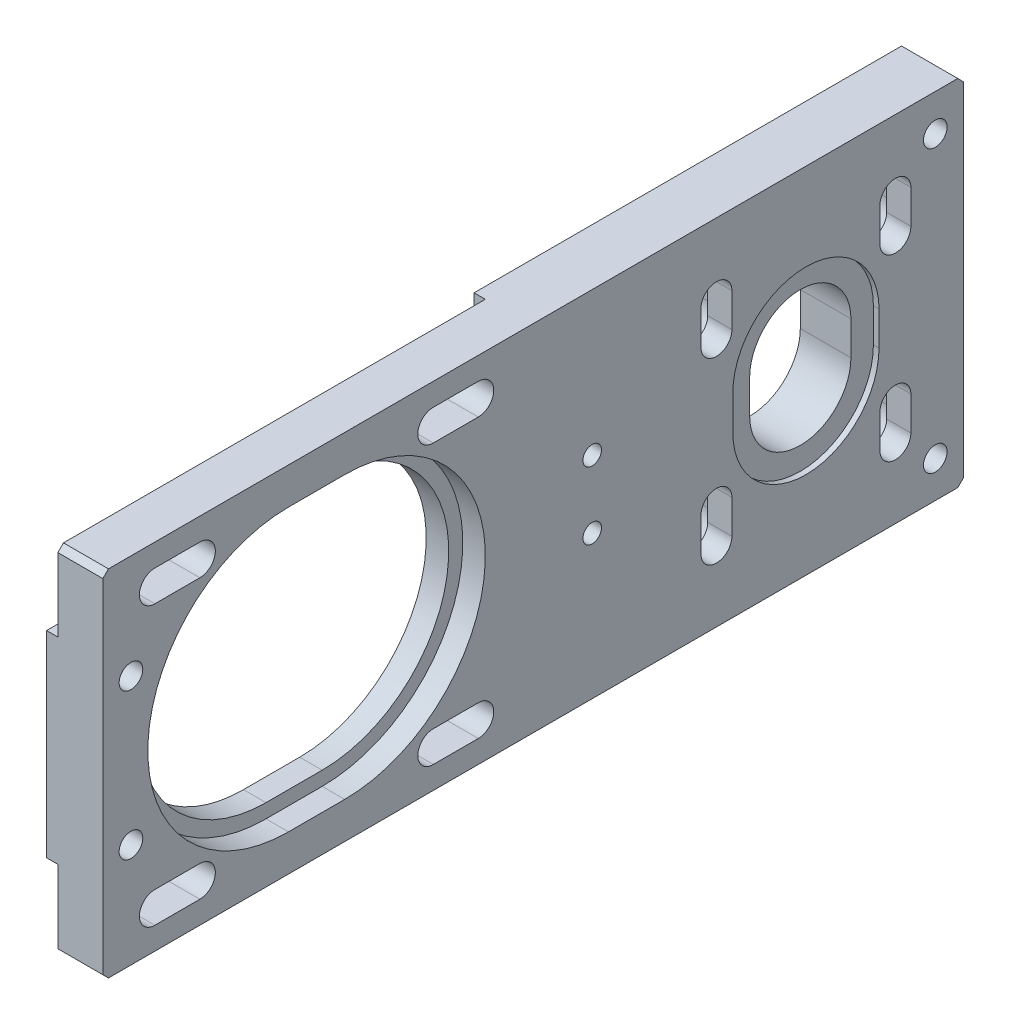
SolidWorks part; units mm, degrees
ref_plane "前视基准面" through (0, 0, 0) normal (0, 0, 1) x (1, 0, 0)
ref_plane "上视基准面" through (0, 0, 0) normal (0, 1, 0) x (1, 0, 0)
ref_plane "右视基准面" through (0, 0, 0) normal (1, 0, 0) x (0, 0, -1)
sketch "草图1" plane through (0, 0, 0) normal (1, 0, 0) x (0, 0, -1)
  line L1 (0, 0) -> (-153, 0)
  line L2 (0, 0) -> (0, 63)
  line L3 (0, 63) -> (-153, 63)
  line L4 (-153, 0) -> (-153, 63)
  dimension "D1" = 63
  dimension "D2" = 153
extrude "凸台-拉伸1" add sketch "草图1" along normal blind 10
sketch "草图2" plane through (10, 0, 0) normal (1, 0, 0) x (0, 0, -1)
  line L1 (0, 0) -> (0, 63) construction
  line L2 (0, 63) -> (-153, 63) construction
  circle A0 centre (-28, 34.5) radius 9
  dimension "D1" = 18
  dimension "D2" = 28
  dimension "D3" = 28.5
extrude "切除-拉伸1" cut sketch "草图2" against normal through all
sketch "草图11" plane through (10, 0, 0) normal (-1, 0, 0) x (0, 0, 1)
  line L0 (120, 31.5) -> (110, 31.5) construction
  line L1 (120, 6.5) -> (110, 6.5)
  line L2 (120, 56.5) -> (110, 56.5)
  line L3 (153, 31.5) -> (97.4502, 31.5) construction
  line L4 (153, 63) -> (153, 0) construction
  arc A0 (120, 6.5) -> (120, 56.5) centre (120, 31.5) ccw
  arc A1 (110, 56.5) -> (110, 6.5) centre (110, 31.5) ccw
  circle A2 centre (28, 34.5) radius 9 construction
  point P2 (115, 31.5)
  dimension "D1" = 50
  dimension "D2" = 10
  dimension "D3" = 87
extrude "切除-拉伸5" cut sketch "草图11" along normal blind 4
sketch "草图12" plane through (6, 0, 0) normal (1, 0, 0) x (0, 0, -1)
  line L0 (-110, 31.5) -> (-120, 31.5) construction
  line L1 (-110, 9) -> (-120, 9)
  line L2 (-110, 54) -> (-120, 54)
  arc A0 (-110, 9) -> (-110, 54) centre (-110, 31.5) ccw
  arc A1 (-120, 54) -> (-120, 9) centre (-120, 31.5) ccw
  point P4 (-115, 31.5)
  dimension "D1" = 45
extrude "切除-拉伸6" cut sketch "草图12" against normal through all
sketch "草图13" plane through (0, 0, 0) normal (-1, 0, 0) x (0, 0, 1)
  line L0 (153, 31.5) -> (97.4235, 31.5) construction
  line L1 (153, -1.5) -> (77, -1.5)
  line L2 (153, -1.5) -> (153, 14)
  line L3 (153, 64.5) -> (77, 64.5)
  line L4 (77, -1.5) -> (77, 64.5)
  line L5 (153, 63) -> (153, 0) construction
  line L8 (153, 64.5) -> (153, 49)
  line L9 (153, 49) -> (105.8579, 49)
  line L11 (153, 14) -> (105.8579, 14)
  line L12 (105.8579, 49) -> (105.8579, 14)
  arc A0 (120, 9) -> (120, 54) centre (120, 31.5) ccw construction
  dimension "D1" = 76
  dimension "D2" = 66
  dimension "D3" = 35
extrude "切除-拉伸7" cut sketch "草图13" against normal blind 2
sketch "草图14" plane through (10, 0, 0) normal (1, 0, 0) x (0, 0, -1)
  line L0 (-86.2513, 6.7513) -> (-94.2513, 6.7513) construction
  line L1 (-86.2513, 4.0013) -> (-94.2513, 4.0013)
  line L2 (-86.2513, 9.5013) -> (-94.2513, 9.5013)
  line L3 (-115, 6.5) -> (-115, 56.5) construction
  line L4 (-110, 6.5) -> (-120, 6.5) construction
  line L6 (-115, 31.5) -> (-95.9763, 31.5) construction
  line L7 (-115, 31.5) -> (-90.2513, 6.7513) construction
  line L8 (-86.2513, 56.2487) -> (-94.2513, 56.2487) construction
  line L9 (-86.2513, 53.4987) -> (-94.2513, 53.4987)
  line L10 (-86.2513, 58.9987) -> (-94.2513, 58.9987)
  line L11 (-135.7487, 56.2487) -> (-143.7487, 56.2487) construction
  line L12 (-135.7487, 53.4987) -> (-143.7487, 53.4987)
  line L13 (-135.7487, 58.9987) -> (-143.7487, 58.9987)
  line L14 (-135.7487, 6.7513) -> (-143.7487, 6.7513) construction
  line L15 (-135.7487, 4.0013) -> (-143.7487, 4.0013)
  line L16 (-135.7487, 9.5013) -> (-143.7487, 9.5013)
  line L17 (-120, 56.5) -> (-110, 56.5) construction
  arc A0 (-86.2513, 4.0013) -> (-86.2513, 9.5013) centre (-86.2513, 6.7513) ccw
  arc A1 (-94.2513, 9.5013) -> (-94.2513, 4.0013) centre (-94.2513, 6.7513) ccw
  circle A2 centre (-115, 31.5) radius 35 construction
  arc A3 (-86.2513, 53.4987) -> (-86.2513, 58.9987) centre (-86.2513, 56.2487) ccw
  arc A4 (-94.2513, 58.9987) -> (-94.2513, 53.4987) centre (-94.2513, 56.2487) ccw
  arc A5 (-135.7487, 53.4987) -> (-135.7487, 58.9987) centre (-135.7487, 56.2487) ccw
  arc A6 (-143.7487, 58.9987) -> (-143.7487, 53.4987) centre (-143.7487, 56.2487) ccw
  arc A7 (-135.7487, 4.0013) -> (-135.7487, 9.5013) centre (-135.7487, 6.7513) ccw
  arc A8 (-143.7487, 9.5013) -> (-143.7487, 4.0013) centre (-143.7487, 6.7513) ccw
  point P2 (-90.2513, 6.7513)
  point P20 (-90.2513, 56.2487)
  point P27 (-139.7487, 56.2487)
  point P34 (-139.7487, 6.7513)
  dimension "D2" = 70
  dimension "D1" = 5.5
  dimension "D3" = 45
  dimension "D4" = 8
extrude "切除-拉伸8" cut sketch "草图14" against normal through all
hole_wizard "M4 螺纹孔1" positions "草图17" profile "草图16" tap size "M4" standard "GB"
sketch "草图17" plane through (0, 0, 0) normal (-1, 0, 0) x (0, 0, 1)
  line L4 (0, 31.5) -> (153.9599, 31.5) construction
  line L5 (0, 0) -> (0, 63) construction
  arc A0 (110, 54) -> (110, 9) centre (110, 31.5) ccw construction
  point P14 (66, 37.5)
  point P16 (66, 25.5)
  dimension "D1" = 12
  dimension "D2" = 44
sketch "草图16" plane through (0, 37.5, 66) normal (0, 1, 0) x (0, 0, 1)
  line L0 (0, 0) -> (0, 10)
  line L1 (0, 10) -> (1.65, 10)
  line L2 (1.65, 10) -> (1.65, 0)
  line L5 (1.65, 0) -> (0, 0)
  line L11 (0, -6.35) -> (0, 107.95) construction
  dimension "通孔螺纹孔钻头直径" = 3.3
  dimension "通孔螺纹孔钻头深度" = 10
hole_wizard "M5 螺纹孔1" positions "草图18" profile "草图19" tap size "M5" standard "GB"
sketch "草图18" plane through (0, 0, 0) normal (-1, 0, 0) x (0, 0, 1)
  line L0 (153, 31.5) -> (0, 31.5) construction
  line L1 (153, 63) -> (153, 0) construction
  line L2 (0, 0) -> (0, 63) construction
  point P0 (148, 18.5)
  point P2 (148, 44.5)
  point P4 (5, 6.5)
  point P6 (5, 56.5)
  dimension "D1" = 5
  dimension "D2" = 26
  dimension "D3" = 143
  dimension "D4" = 50
sketch "草图19" plane through (0, 18.5, 148) normal (0, 1, 0) x (0, 0, 1)
  line L0 (0, 0) -> (0, 13.6618)
  line L1 (0, 13.6618) -> (2.1, 12.4)
  line L2 (2.1, 12.4) -> (2.1, 0)
  line L5 (2.1, 0) -> (0, 0)
  line L10 (0, 13.6618) -> (-2.1, 12.4) construction
  line L11 (0, -6.35) -> (0, 107.95) construction
  dimension "螺纹孔钻头直径" = 4.2
  dimension "螺纹孔钻头深度" = 12.4
  dimension "导头角度" = 118
hole_wizard "打孔尺寸(%根据)内六角圆柱头螺钉的类型1" positions "草图20" profile "草图21" counterbore size "M5" standard "GB"
sketch "草图20" plane through (0, 0, 0) normal (-1, 0, 0) x (0, 0, 1)
  line L0 (28, 34.5) -> (28, -4.0232) construction
  line L2 (28, 34.5) -> (-15.1581, 34.5) construction
  line L4 (28, 34.5) -> (-2.9661, 3.5339) construction
  circle A0 centre (28, 34.5) radius 22.5 construction
  point P0 (43.9099, 18.5901)
  point P2 (12.0901, 18.5901)
  point P4 (12.0901, 50.4099)
  point P6 (43.9099, 50.4099)
  dimension "D2" = 45
  dimension "D1" = 45
sketch "草图21" plane through (0, 18.5901, 43.9099) normal (0, 1, 0) x (0, 0, 1)
  line L0 (0, 0) -> (0, 10)
  line L1 (0, 10) -> (2.75, 10)
  line L3 (2.75, 10) -> (2.75, 5.7)
  line L4 (2.75, 5.7) -> (5, 5.7)
  line L5 (5, 5.7) -> (5, 0)
  line L7 (5, 0) -> (0, 0)
  line L11 (0, -6.35) -> (0, 107.95) construction
  dimension "通孔孔直径" = 5.5
  dimension "通孔孔深度" = 10
  dimension "柱形沉头孔直径" = 10
  dimension "柱形沉头孔深度" = 5.7
chamfer "倒角1" distance 1 angle 45 4 edges at (5, 0, 0) (5, 63, 0) (6, 63, 153) (6, 0, 153)
fillet "圆角2" radius 2 2 edges at (1, 14, 134.1421) (1, 49, 134.1421)
sketch "草图25" plane through (0, 0, 0) normal (-1, 0, 0) x (0, 0, 1)
  line L0 (43.9099, 18.5901) -> (43.9099, 12.5901) construction
  line L1 (48.9099, 18.5901) -> (48.9099, 12.5901)
  line L2 (38.9099, 18.5901) -> (38.9099, 12.5901)
  line L3 (12.0901, 18.5901) -> (12.0901, 12.5901) construction
  line L4 (17.0901, 18.5901) -> (17.0901, 12.5901)
  line L5 (7.0901, 18.5901) -> (7.0901, 12.5901)
  line L6 (43.9099, 50.4099) -> (43.9099, 44.4099) construction
  line L7 (48.9099, 50.4099) -> (48.9099, 44.4099)
  line L8 (38.9099, 50.4099) -> (38.9099, 44.4099)
  line L9 (12.0901, 50.4099) -> (12.0901, 44.4099) construction
  line L10 (17.0901, 50.4099) -> (17.0901, 44.4099)
  line L11 (7.0901, 50.4099) -> (7.0901, 44.4099)
  arc A0 (48.9099, 18.5901) -> (38.9099, 18.5901) centre (43.9099, 18.5901) ccw
  arc A1 (38.9099, 12.5901) -> (48.9099, 12.5901) centre (43.9099, 12.5901) ccw
  circle A2 centre (43.9099, 18.5901) radius 5 construction
  arc A3 (17.0901, 18.5901) -> (7.0901, 18.5901) centre (12.0901, 18.5901) ccw
  arc A4 (7.0901, 12.5901) -> (17.0901, 12.5901) centre (12.0901, 12.5901) ccw
  arc A5 (48.9099, 50.4099) -> (38.9099, 50.4099) centre (43.9099, 50.4099) ccw
  arc A6 (38.9099, 44.4099) -> (48.9099, 44.4099) centre (43.9099, 44.4099) ccw
  arc A7 (17.0901, 50.4099) -> (7.0901, 50.4099) centre (12.0901, 50.4099) ccw
  arc A8 (7.0901, 44.4099) -> (17.0901, 44.4099) centre (12.0901, 44.4099) ccw
  point P3 (43.9099, 15.5901)
  point P13 (12.0901, 15.5901)
  point P21 (43.9099, 47.4099)
  point P29 (12.0901, 47.4099)
  dimension "D1" = 6
extrude "切除-拉伸12" cut sketch "草图25" against normal up to surface (5.7 mm away)
sketch "草图26" plane through (5.7, 0, 0) normal (-1, 0, 0) x (0, 0, 1)
  line L0 (43.9099, 18.5901) -> (43.9099, 12.5901) construction
  line L1 (46.6599, 18.5901) -> (46.6599, 12.5901)
  line L2 (41.1599, 18.5901) -> (41.1599, 12.5901)
  line L3 (12.0901, 18.5901) -> (12.0901, 12.5901) construction
  line L4 (14.8401, 18.5901) -> (14.8401, 12.5901)
  line L5 (9.3401, 18.5901) -> (9.3401, 12.5901)
  line L6 (43.9099, 50.4099) -> (43.9099, 44.4099) construction
  line L7 (46.6599, 50.4099) -> (46.6599, 44.4099)
  line L8 (41.1599, 50.4099) -> (41.1599, 44.4099)
  line L9 (12.0901, 50.4099) -> (12.0901, 44.4099) construction
  line L10 (14.8401, 50.4099) -> (14.8401, 44.4099)
  line L11 (9.3401, 50.4099) -> (9.3401, 44.4099)
  arc A0 (46.6599, 18.5901) -> (41.1599, 18.5901) centre (43.9099, 18.5901) ccw
  arc A1 (41.1599, 12.5901) -> (46.6599, 12.5901) centre (43.9099, 12.5901) ccw
  circle A2 centre (43.9099, 18.5901) radius 2.75 construction
  arc A3 (14.8401, 18.5901) -> (9.3401, 18.5901) centre (12.0901, 18.5901) ccw
  arc A4 (9.3401, 12.5901) -> (14.8401, 12.5901) centre (12.0901, 12.5901) ccw
  arc A5 (46.6599, 50.4099) -> (41.1599, 50.4099) centre (43.9099, 50.4099) ccw
  arc A6 (41.1599, 44.4099) -> (46.6599, 44.4099) centre (43.9099, 44.4099) ccw
  arc A7 (14.8401, 50.4099) -> (9.3401, 50.4099) centre (12.0901, 50.4099) ccw
  arc A8 (9.3401, 44.4099) -> (14.8401, 44.4099) centre (12.0901, 44.4099) ccw
  point P3 (43.9099, 15.5901)
  point P14 (12.0901, 15.5901)
  point P21 (43.9099, 47.4099)
  point P29 (12.0901, 47.4099)
  dimension "D1" = 6
extrude "切除-拉伸13" cut sketch "草图26" against normal through all
sketch "草图27" plane through (0, 0, 0) normal (-1, 0, 0) x (0, 0, 1)
  line L0 (28, 34.5) -> (28, 28.5) construction
  line L1 (37, 34.5) -> (37, 28.5)
  line L2 (19, 34.5) -> (19, 28.5)
  arc A0 (37, 34.5) -> (19, 34.5) centre (28, 34.5) ccw
  arc A1 (19, 28.5) -> (37, 28.5) centre (28, 28.5) ccw
  circle A2 centre (28, 34.5) radius 9 construction
  point P3 (28, 31.5)
  dimension "D1" = 6
extrude "切除-拉伸14" cut sketch "草图27" against normal through all
sketch "草图28" plane through (10, 0, 0) normal (1, 0, 0) x (0, 0, -1)
  line L0 (-28, 34.5) -> (-28, 28.5) construction
  line L1 (-15, 34.5) -> (-15, 28.5)
  line L2 (-41, 34.5) -> (-41, 28.5)
  arc A0 (-15, 34.5) -> (-41, 34.5) centre (-28, 34.5) ccw
  arc A1 (-41, 28.5) -> (-15, 28.5) centre (-28, 28.5) ccw
  point P4 (-28, 31.5)
  dimension "D1" = 13
extrude "切除-拉伸15" cut sketch "草图28" against normal blind 1
other "冻结***"
